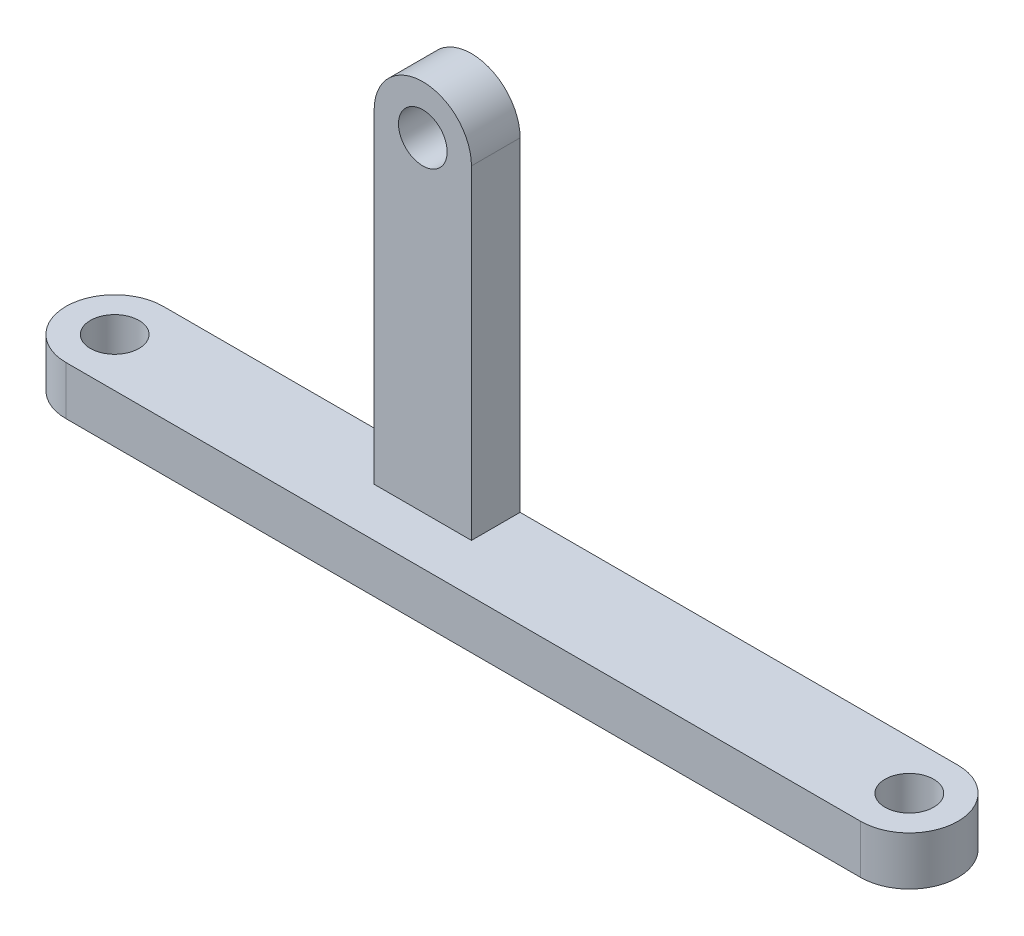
SolidWorks part; units mm, degrees
ref_plane "Front Plane" through (0, 0, 0) normal (0, 0, 1) x (1, 0, 0)
ref_plane "Top Plane" through (0, 0, 0) normal (0, 1, 0) x (1, 0, 0)
ref_plane "Right Plane" through (0, 0, 0) normal (1, 0, 0) x (0, 0, -1)
sketch "Sketch1" plane through (0, 0, 0) normal (0, 0, 1) x (1, 0, 0)
  line L3 (0, 17) -> (0, 0) construction
  line L4 (3, 17) -> (3, 0)
  line L5 (-3, 17) -> (-3, 0)
  line L6 (-3, 0) -> (-3, -3)
  line L11 (-3, -3) -> (3, -3)
  line L12 (3, -3) -> (3, 0)
  arc A2 (3, 17) -> (-3, 17) centre (0, 17) ccw
  arc A3 (-3, 0) -> (3, 0) centre (0, 0) ccw
  circle A4 centre (0, 17) radius 1.5
  point P10 (0, 8.5)
  point P15 (0, -3)
  dimension "D3" = 3
extrude "Boss-Extrude1" add sketch "Sketch1" along normal blind 3
sketch "Sketch2" plane through (0, -3, 0) normal (0, -1, 0) x (1, 0, 0)
  line L0 (-19, 3) -> (30, 3) construction
  line L1 (-19, 6) -> (30, 6)
  line L2 (-19, 0) -> (30, 0)
  line L3 (-3, 0) -> (3, 0) construction
  line L4 (0, 0) -> (0, 16.4633) construction
  arc A0 (-19, 6) -> (-19, 0) centre (-19, 3) ccw
  arc A1 (30, 0) -> (30, 6) centre (30, 3) ccw
  circle A2 centre (-19, 3) radius 1.5
  circle A3 centre (30, 3) radius 1.5
  point P2 (5.5, 3)
  dimension "D1" = 3
  dimension "D4" = 3
  dimension "D5" = 3
  dimension "D2" = 49
  dimension "D3" = 5.5
extrude "Boss-Extrude2" add sketch "Sketch2" along normal blind 3
